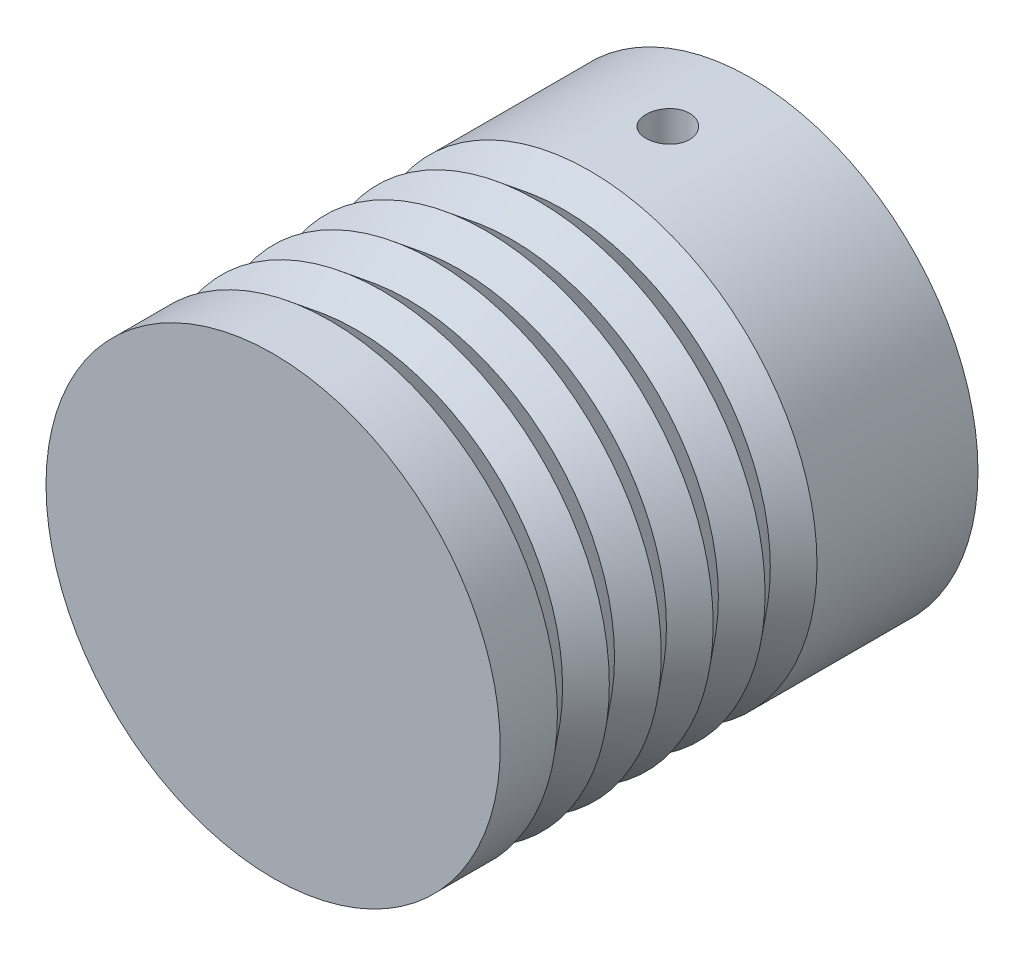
SolidWorks part; units mm, degrees
ref_plane "Alzado" through (0, 0, 0) normal (0, 0, 1) x (1, 0, 0)
ref_plane "Planta" through (0, 0, 0) normal (0, 1, 0) x (1, 0, 0)
ref_plane "Vista lateral" through (0, 0, 0) normal (1, 0, 0) x (0, 0, -1)
other "Graphic1"
other "Graphic (Closed) -1"
imported_body "Imported1"
other "Convert Mesh to Standard1"
sketch "Sketch2" plane through (0, 0, -9) normal (0, 0, -1) x (-1, 0, 0)
  circle A0 centre (0, 0) radius 10.9341
  circle A1 centre (0, 0) radius 2.5181
  circle A2 centre (0, 0) radius 2.5181 construction
  circle A3 centre (0, 0) radius 10.9341 construction
extrude "Boss-Extrude1" add sketch "Sketch2" along normal blind 5
ref_plane "Plane1" through (0, 11, 0) normal (0, 1, 0) x (1, 0, 0)
sketch "Sketch3" plane through (0, 11, 0) normal (0, 1, 0) x (1, 0, 0)
  line L0 (2.5181, 14) -> (-2.5181, 14) construction
  circle A0 centre (0, 10) radius 1.05
  dimension "D1" = 2.1
  dimension "D2" = 4
extrude "Cut-Extrude1" cut sketch "Sketch3" against normal blind 26
sketch "Sketch5" plane through (0, 0, -14) normal (0, 0, -1) x (-1, 0, 0)
  circle A0 centre (0, 0) radius 6.1348
extrude "Boss-Extrude2" add sketch "Sketch5" against normal blind 20
sketch "Sketch6" plane through (0, 0, -14) normal (0, 0, -1) x (-1, 0, 0)
  circle A0 centre (0, 0) radius 1.84
  dimension "D1" = 3.68
extrude "Cut-Extrude3" cut sketch "Sketch6" against normal blind 8
scale "Scale3" bodies to scale 108 scale about centroid uniform scaling yes scale factor 1.375
ref_plane "Plane2" through (0, 15.0344, 0) normal (0, 1, 0) x (1, 0, 0)
sketch "Sketch7" plane through (0, 15.0344, 0) normal (0, 1, 0) x (1, 0, 0)
  circle A0 centre (0, 12.8056) radius 1.4438
  circle A1 centre (0, 12.8056) radius 1.4438 construction
extrude "Cut-Extrude4" cut sketch "Sketch7" against normal blind 36
